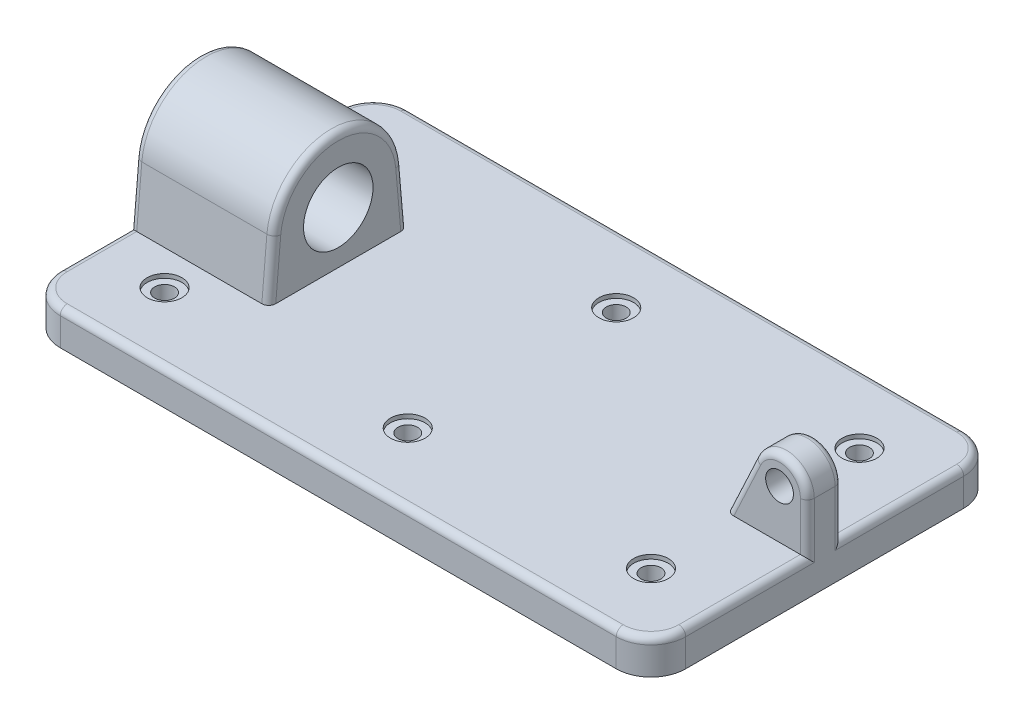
SolidWorks part; units mm, degrees
ref_plane "Plane1" through (0, 0, 0) normal (0, 0, 1) x (1, 0, 0)
ref_plane "Plane2" through (0, 0, 0) normal (0, 1, 0) x (1, 0, 0)
ref_plane "Plane3" through (0, 0, 0) normal (1, 0, 0) x (0, 0, -1)
sketch "Sketch1" plane through (0, 0, 0) normal (0, 0, 1) x (1, 0, 0)
  line L0 (0, 0) -> (114.3, 0)
  line L1 (0, 0) -> (0, 6.35)
  line L2 (114.3, 6.35) -> (0, 6.35)
  line L3 (114.3, 6.35) -> (114.3, 0)
  dimension "D1" = 114.3
  dimension "D2" = 6.35
extrude "Base-Extrude" add sketch "Sketch1" along normal mid plane 63.5
sketch "Sketch2" plane through (0, 0, 0) normal (0, 0, 1) x (1, 0, 0)
  line L0 (114.3, 6.35) -> (114.3, 15.24)
  line L1 (104.616, 17.3869) -> (99.4694, 6.35)
  line L2 (114.3, 6.35) -> (0, 6.35) construction
  line L3 (99.4694, 6.35) -> (114.3, 6.35)
  line L4 (0, 0) -> (114.3, 0) construction
  arc A0 (114.3, 15.24) -> (104.616, 17.3869) centre (109.22, 15.24) ccw
  dimension "D1" = 5.08
  dimension "D2" = 15.24
  dimension "D3" = 65
extrude "lever boss" add sketch "Sketch2" along normal mid plane 6.35
sketch "Sketch3" plane through (0, 0, 0) normal (-1, 0, 0) x (0, 0, 1)
  line L0 (0, 0) -> (0, 31.6598) construction
  line L1 (12.7, 6.35) -> (11.7765, 16.9053)
  line L2 (31.75, 6.35) -> (-31.75, 6.35) construction
  line L3 (-12.7, 6.35) -> (-11.7765, 16.9053)
  line L4 (-12.7, 6.35) -> (12.7, 6.35)
  arc A0 (-11.7765, 16.9053) -> (11.7765, 16.9053) centre (0, 15.875) cw
  dimension "D2" = 9.525
  dimension "D1" = 25.4
  dimension "D3" = 85
extrude "Boss-Extrude2" add sketch "Sketch3" against normal blind 25.4
fillet "Fillet1" radius 6.35 5 edges at (114.3, 3.175, 31.75) (0, 3.175, 31.75) (114.3, 3.175, -31.75) (0, 3.175, -31.75)
hole_wizard "Hole1" positions "Sketch5" profile "Sketch4" legacy
sketch "Sketch5" plane through (0, 0, 3.175) normal (0, 0, 1) x (1, 0, 0)
  arc A0 (114.3, 15.24) -> (104.616, 17.3869) centre (109.22, 15.24) ccw construction
  point P0 (109.22, 15.24)
sketch "Sketch4" plane through (109.22, 15.24, 3.175) normal (1, 0, 0) x (0, -1, 0)
  line L0 (0, 0) -> (0, 34.925)
  line L1 (0, 34.925) -> (2.54, 34.925)
  line L2 (2.54, 34.925) -> (2.54, 0)
  line L3 (2.54, 0) -> (0, 0)
  line L4 (0, 110) -> (0, -10) construction
  dimension "Diameter" = 5.08
  dimension "Depth" = 34.925
hole_wizard "Hole2" positions "Sketch6" profile "Sketch7" legacy
sketch "Sketch6" plane through (25.4, 3.19, 95.1751) normal (1, 0, 0) x (0, 0, -1)
  arc A1 (106.9516, 13.7153) -> (83.3985, 13.7153) centre (95.1751, 12.685) ccw construction
  point P0 (95.1751, 12.685)
sketch "Sketch7" plane through (25.4, 15.875, 0) normal (0, 1, 0) x (0, 0, -1)
  line L0 (0, 0) -> (0, 25.4)
  line L1 (0, 25.4) -> (6.35, 25.4)
  line L2 (6.35, 25.4) -> (6.35, 0)
  line L3 (6.35, 0) -> (0, 0)
  line L4 (0, 110) -> (0, -10) construction
  dimension "Diameter" = 12.7
  dimension "Depth" = 25.4
sketch "Sketch8" plane through (72.2885, 6.35, 6.6308) normal (0, 1, 0) x (-1, 0, 0)
  line L0 (-35.6615, 25.1192) -> (65.9385, 25.1192) construction
  line L1 (-42.0115, 18.7692) -> (-42.0115, -3.4558) construction
  point P0 (-29.3115, 12.4192)
  dimension "D1" = 12.7
  dimension "D2" = 12.7
sketch "Sketch9" plane through (101.6, 6.35, 19.05) normal (1, 0, 0) x (0, 0, 1)
  line L0 (0, 0) -> (0, 6.35)
  line L1 (0, 6.35) -> (1.8034, 6.35)
  line L2 (1.8034, 6.35) -> (1.8034, 0.762)
  line L3 (1.8034, 0.762) -> (3.175, 0.762)
  line L4 (3.175, 0.762) -> (3.175, 0)
  line L5 (3.175, 0) -> (0, 0)
  line L6 (0, 110) -> (0, -10) construction
  dimension "Diameter" = 3.6068
  dimension "Depth" = 6.35
  dimension "C-Bore Diameter" = 6.35
  dimension "C-Bore Depth" = 0.762
hole_wizard "#4 spotface hole1" positions "Sketch8" profile "Sketch9" legacy
pattern_linear "LPattern1" count 3 spacing 44.45 along (-1, 0, 0) count 2 spacing 38.1 along (0, 0, -1) of "#4 spotface hole1"
fillet "Fillet2" radius 1.27 24 edges at (110.3195, 20.1996, -3.175) (102.0427, 11.8685, -3.175) (110.3195, 20.1996, 3.175) (102.0427, 11.8685, 3.175) (0, 6.35, -19.05) (0, 11.6277, -12.2383) (0, 27.6965, 0) (25.4, 11.6277, 12.2383) (25.4, 11.6277, -12.2383) (25.4, 27.6965, 0) (0, 11.6277, 12.2383) (57.15, 6.35, -31.75) (0, 6.35, 19.05) (57.15, 6.35, 31.75) (112.4401, 6.35, -29.8901) (112.4401, 6.35, 29.8901) (1.8599, 6.35, 29.8901) (1.8599, 6.35, -29.8901)
equation "\"D3@LPattern1\"  = ( \"D1@Sketch1\"  - (\"D2@Sketch8\" * 2))  / (\"D1@LPattern1\" -1)"
